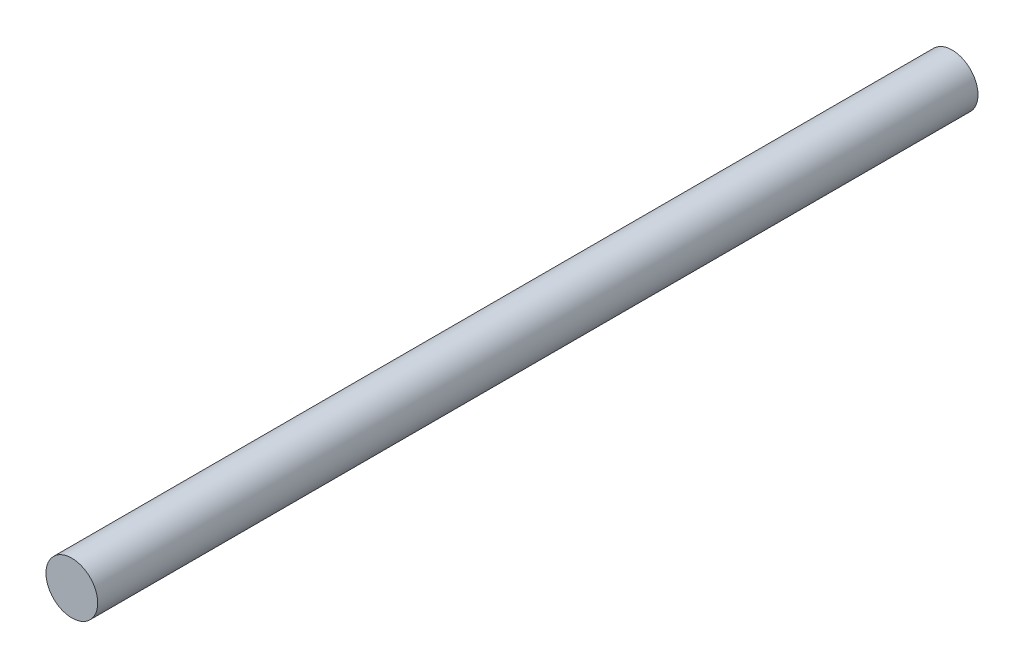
SolidWorks part; units mm, degrees
ref_plane "Front Plane" through (0, 0, 0) normal (0, 0, 1) x (1, 0, 0)
ref_plane "Top Plane" through (0, 0, 0) normal (0, 1, 0) x (1, 0, 0)
ref_plane "Right Plane" through (0, 0, 0) normal (1, 0, 0) x (0, 0, -1)
sketch "Sketch1" plane through (0, 0, 0) normal (0, 0, 1) x (1, 0, 0)
  circle A0 centre (0, 0) radius 6.35
  dimension "D1" = 12.7
extrude "Boss-Extrude1" add sketch "Sketch1" along normal mid plane 215.9
